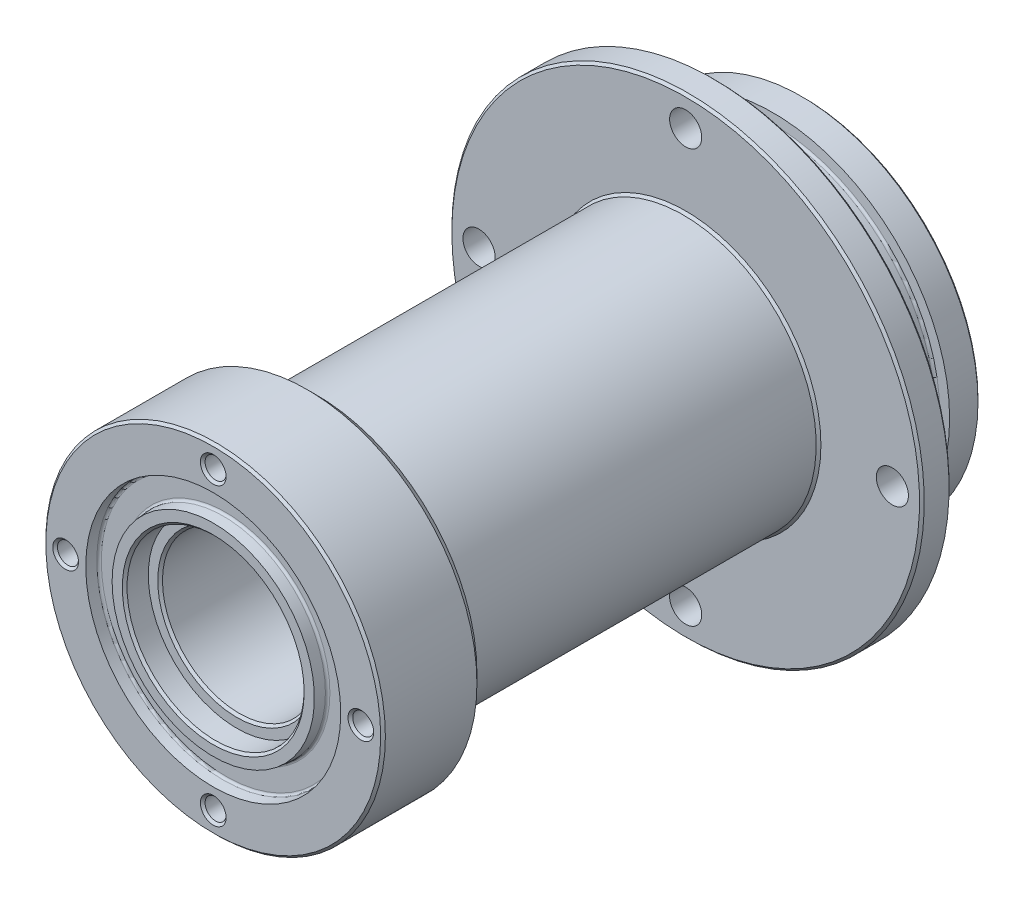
SolidWorks part; units mm, degrees
ref_plane "Front" through (0, 0, 0) normal (0, 0, 1) x (1, 0, 0)
ref_plane "Top" through (0, 0, 0) normal (0, 1, 0) x (1, 0, 0)
ref_plane "Right" through (0, 0, 0) normal (1, 0, 0) x (0, 0, -1)
sketch "Sketch1" plane through (0, 0, 0) normal (0, 0, 1) x (1, 0, 0)
  circle A1 centre (0, 0) radius 18.2562
  circle A2 centre (0, 0) radius 7.9883
  circle A3 centre (0, 0) radius 7.9883
  dimension "D2" = 36.5125
  dimension "D1" = 0.0508
extrude "body" add sketch "Sketch1" along normal blind 63.5
sketch "Sketch2" plane through (0, 0, 63.5) normal (0, 0, 1) x (1, 0, 0)
  line L0 (-21.6144, 0) -> (24.8277, 0) construction
  line L1 (0, 20.5516) -> (0, -21.146) construction
  circle A0 centre (0, 0) radius 15.875 construction
  circle A1 centre (0, 15.875) radius 1.1303
  circle A2 centre (15.875, 0) radius 1.1303
  circle A3 centre (0, -15.875) radius 1.1303
  circle A4 centre (-15.875, 0) radius 1.1303
  circle A5 centre (15.875, 0) radius 2.3241 construction
  dimension "D1" = 31.75
  dimension "D2" = 2.2606
  dimension "D3" = 2.2606
  dimension "D4" = 2.2606
  dimension "D5" = 2.2606
  dimension "D6" = 4.6482
extrude "4-40 holes" cut sketch "Sketch2" against normal blind 12.7
ref_plane "Plane1" through (0, 0, 63.5) normal (-1, 0, 0) x (0, -1, 0)
ref_plane "Plane2" through (0, 0, 63.5) normal (-1, 0, 0) x (0, -1, 0)
ref_plane "Plane3" through (0, 0, 63.5) normal (-1, 0, 0) x (0, -1, 0)
sketch "Sketch5" plane through (0, 0, 63.5) normal (-1, 0, 0) x (0, -1, 0)
  line L0 (10.9728, -1.0889) -> (10.8775, 0)
  line L1 (10.8775, 0) -> (13.7097, 0)
  line L2 (13.7097, 0) -> (13.6144, -1.0889)
  line L3 (13.3614, -1.3208) -> (11.2258, -1.3208)
  line L4 (0, 50) -> (0, -50) construction
  arc A0 (13.6144, -1.0889) -> (13.3614, -1.3208) centre (13.3614, -1.0668) cw
  arc A1 (11.2258, -1.3208) -> (10.9728, -1.0889) centre (11.2258, -1.0668) cw
revolve "Groove for AS 568-020, O-Ring1" cut sketch "Sketch5"
sketch "Sketch6" plane through (0, 0, 63.5) normal (0, 0, 1) x (1, 0, 0)
  circle A0 centre (0, 0) radius 9.525
  dimension "D1" = 19.05
extrude "Cut-Extrude2" cut sketch "Sketch6" against normal blind 2.54
chamfer "connector side" distance 0.254 angle 45 6 edges at (-14.7447, 0, 63.5) (1.1303, -15.875, 63.5) (17.0053, 0, 63.5) (1.1303, 15.875, 63.5) (18.2562, 0, 63.5) (9.525, 0, 63.5)
sketch "Sketch8" plane through (0, 0, 0) normal (1, 0, 0) x (0, 0, -1)
  line L0 (3.3064, 0) -> (-65.0739, 0) construction
  line L1 (-63.5, 18.0022) -> (-63.5, -18.0022) construction
  line L2 (-52.3875, 21.2504) -> (-12.7, 21.2504)
  line L3 (-52.3875, 21.2504) -> (-52.3875, 14.2875)
  line L4 (-52.3875, 14.2875) -> (-12.7, 14.2875)
  line L5 (-12.7, 21.2504) -> (-12.7, 14.2875)
  line L7 (0, -18.2562) -> (0, 18.2562) construction
  dimension "D1" = 28.575
  dimension "D2" = 11.1125
  dimension "D3" = 12.7
revolve "center cut" cut sketch "Sketch8" angle 360 about L0
chamfer "center" distance 1.016 angle 45 2 edges at (-18.2562, 0, 12.7) (18.2562, 0, 52.3875)
ref_plane "Plane4" through (0, 0, 63.5) normal (-1, 0, 0) x (0, 1, 0)
sketch "Sketch11" plane through (0, 0, 0) normal (1, 0, 0) x (0, 0, -1)
  line L0 (3.5771, 0) -> (-26.4171, 0) construction
  line L4 (-12.7, 16.3961) -> (0, 16.3961)
  line L5 (-12.7, 25.4) -> (-9.525, 25.4)
  line L6 (0, -18.2562) -> (0, 18.2562) construction
  line L8 (-9.525, 18.9865) -> (0, 18.9865)
  line L10 (-12.7, 17.2402) -> (-12.7, -17.2402) construction
  line L11 (0, 16.3961) -> (0, 18.9865)
  line L12 (-9.525, 18.9865) -> (-9.525, 25.4)
  line L13 (-12.7, 25.4) -> (-12.7, 16.3961)
  dimension "D1" = 9.525
  dimension "D2" = 50.8
  dimension "D3" = 37.973
revolve "flange" add sketch "Sketch11" angle 360 about L0
ref_plane "Plane5" through (0, 0, -3.5771) normal (-1, 0, 0) x (0, 1, 0)
sketch "Sketch13" plane through (0, 0, -3.5771) normal (-1, 0, 0) x (0, 1, 0)
  line L0 (18.0119, -6.9676) -> (19.1389, -6.869)
  line L1 (19.1389, -6.869) -> (19.1389, -9.4284)
  line L2 (19.1389, -9.4284) -> (18.0119, -9.3298)
  line L3 (17.78, -9.0768) -> (17.78, -7.2207)
  line L4 (0, 50) -> (0, -50) construction
  arc A0 (18.0119, -9.3298) -> (17.78, -9.0768) centre (18.034, -9.0768) cw
  arc A1 (17.78, -7.2207) -> (18.0119, -6.9676) centre (18.034, -7.2207) cw
revolve "Groove for AS 568-028, O-Ring1" cut sketch "Sketch13" angle 360 about L4
chamfer "Chamfer5" distance 0.254 angle 45 6 edges at (-18.9865, 0, 0) (7.9883, 0, 0) (-25.4, 0, 9.525) (-25.4, 0, 12.7) (-14.2875, 0, 52.3875) (-14.2875, 0, 12.7)
sketch "Sketch14" plane through (0, 0, 9.525) normal (0, 0, -1) x (-1, 0, 0)
  line L0 (0, 24.9344) -> (0, -25.565) construction
  line L1 (-28.7179, 0) -> (26.9313, 0) construction
  circle A0 centre (0, 0) radius 22.225 construction
  circle A1 centre (0, 22.225) radius 1.7272
  circle A2 centre (-22.225, 0) radius 1.7272
  circle A3 centre (0, -22.225) radius 1.7272
  circle A4 centre (22.225, 0) radius 1.7272
  dimension "D1" = 44.45
  dimension "D2" = 3.4544
  dimension "D3" = 3.4544
  dimension "D4" = 3.4544
  dimension "D5" = 3.4544
extrude "mount holes" cut sketch "Sketch14" against normal through all
sketch "Sketch15" plane through (0, 0, 0) normal (0, 1, 0) x (1, 0, 0)
  line L0 (0, 0) -> (0, -65.1803) construction
  line L1 (0, -19.05) -> (0, -65.6967)
  line L2 (0, -19.05) -> (8.128, -19.05)
  line L3 (8.255, -25.4) -> (8.255, -65.6967)
  line L4 (8.255, -65.6967) -> (0, -65.6967)
  line L5 (8.2423, 0) -> (-8.2423, 0) construction
  line L6 (8.255, -25.4) -> (8.128, -25.4)
  line L7 (8.128, -25.4) -> (8.128, -19.05)
  dimension "D1" = 19.05
  dimension "D2" = 16.51
  dimension "D3" = 6.35
  dimension "D4" = 0.127
revolve "internal thread and bore" cut sketch "Sketch15" angle 360 about L0
chamfer "intrenal bore" distance 0.254 angle 45 1 edges at (8.255, 0, 60.96)
